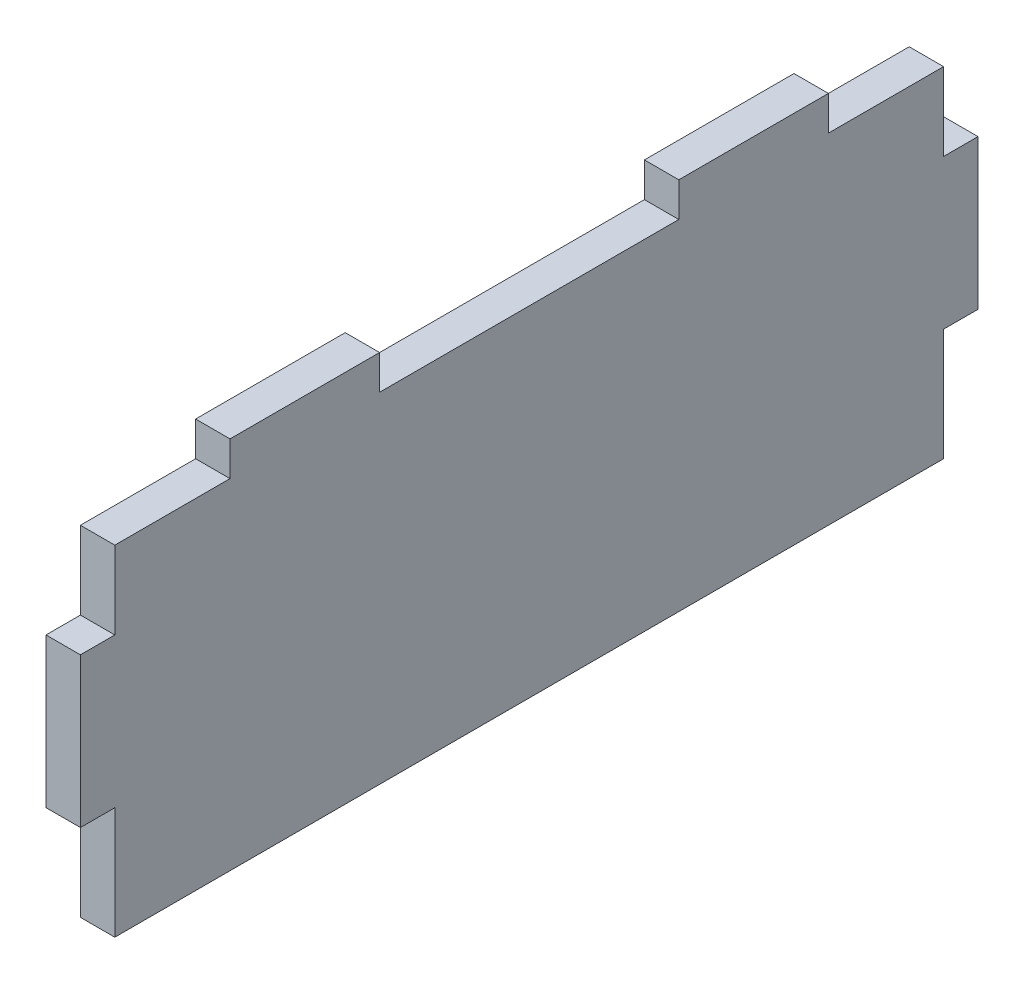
SolidWorks part; units mm, degrees
ref_plane "Front Plane" through (0, 0, 0) normal (0, 0, 1) x (1, 0, 0)
ref_plane "Top Plane" through (0, 0, 0) normal (0, 1, 0) x (1, 0, 0)
ref_plane "Right Plane" through (0, 0, 0) normal (1, 0, 0) x (0, 0, -1)
sketch "Sketch1" plane through (0, 0, 0) normal (1, 0, 0) x (0, 0, -1)
  line L0 (5.842, -4.2262) -> (5.842, 14.8238)
  line L1 (5.842, -4.2262) -> (146.558, -4.2262)
  line L2 (0, 14.8238) -> (0, 40.2238)
  line L3 (76.2, -4.2262) -> (76.2, 18.42) construction
  line L4 (152.4, 14.8238) -> (152.4, 40.2238)
  line L5 (5.842, 14.8238) -> (0, 14.8238)
  line L6 (0, 40.2238) -> (5.842, 40.2238)
  line L7 (5.842, 40.2238) -> (5.842, 53.4318)
  line L8 (5.842, 53.4318) -> (25.4, 53.4318)
  line L9 (25.4, 53.4318) -> (25.4, 59.2738)
  line L10 (25.4, 59.2738) -> (50.8, 59.2738)
  line L11 (152.4, 40.2238) -> (146.558, 40.2238)
  line L12 (146.558, 14.8238) -> (152.4, 14.8238)
  line L13 (152.4, 14.8238) -> (152.4, 40.2238)
  line L14 (146.558, -4.2262) -> (146.558, 14.8238)
  line L15 (127, 53.4318) -> (127, 59.2738)
  line L16 (146.558, 53.4318) -> (127, 53.4318)
  line L17 (146.558, 40.2238) -> (146.558, 53.4318)
  line L18 (50.8, 59.2738) -> (50.8, 53.4318)
  line L19 (50.8, 53.4318) -> (101.6, 53.4318)
  line L20 (101.6, 53.4318) -> (101.6, 59.2738)
  line L21 (101.6, 59.2738) -> (127, 59.2738)
  dimension "D1" = 5.842
  dimension "D2" = 5.842
  dimension "D3" = 5.842
  dimension "D4" = 19.05
  dimension "D5" = 25.4
  dimension "D6" = 63.5
  dimension "D7" = 152.4
  dimension "D8" = 25.4
  dimension "D9" = 76.2
  dimension "D10" = 25.4
  dimension "D11" = 25.4
extrude "Boss-Extrude1" add sketch "Sketch1" along normal blind 5.842
